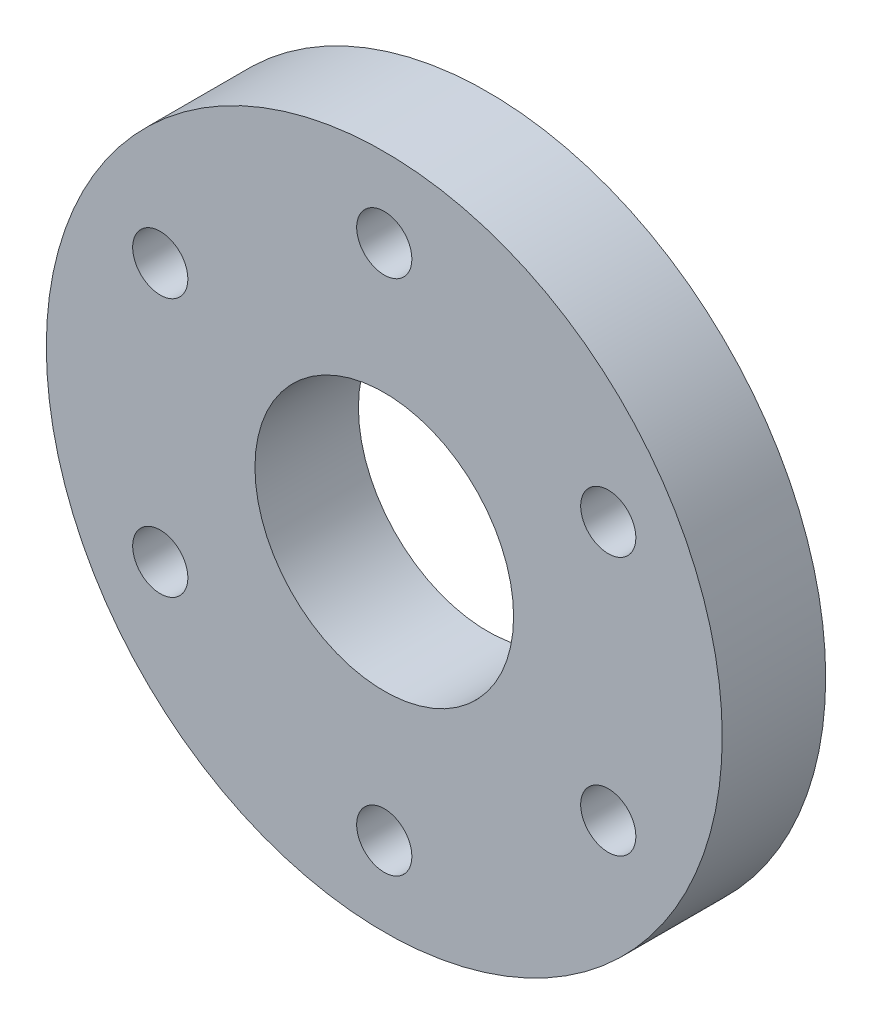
SolidWorks part; units mm, degrees
ref_plane "Front Plane" through (0, 0, 0) normal (0, 0, 1) x (1, 0, 0)
ref_plane "Top Plane" through (0, 0, 0) normal (0, 1, 0) x (1, 0, 0)
ref_plane "Right Plane" through (0, 0, 0) normal (1, 0, 0) x (0, 0, -1)
sketch "Sketch1" plane through (0, 0, 0) normal (0, 0, 1) x (1, 0, 0)
  circle A0 centre (0, 0) radius 24.892
  dimension "D1" = 49.784
extrude "Boss-Extrude1" add sketch "Sketch1" along normal blind 7.62
sketch "Sketch3" plane through (0, 0, 7.62) normal (0, 0, 1) x (1, 0, 0)
  circle A0 centre (0, 0) radius 9.525
  dimension "D1" = 19.05
extrude "Cut-Extrude1" cut sketch "Sketch3" against normal through all
sketch "Sketch4" plane through (0, 0, 7.62) normal (0, 0, 1) x (1, 0, 0)
  circle A0 centre (0, 19.05) radius 2.032
  circle A1 centre (0, 0) radius 9.525 construction
  dimension "D1" = 4.064
  dimension "D2" = 19.05
extrude "Cut-Extrude2" cut sketch "Sketch4" against normal through all
pattern_circular "CirPattern2" count 6 every 60 about axis through (0, 0, 0) along (0, 0, 1) of "Cut-Extrude2"
